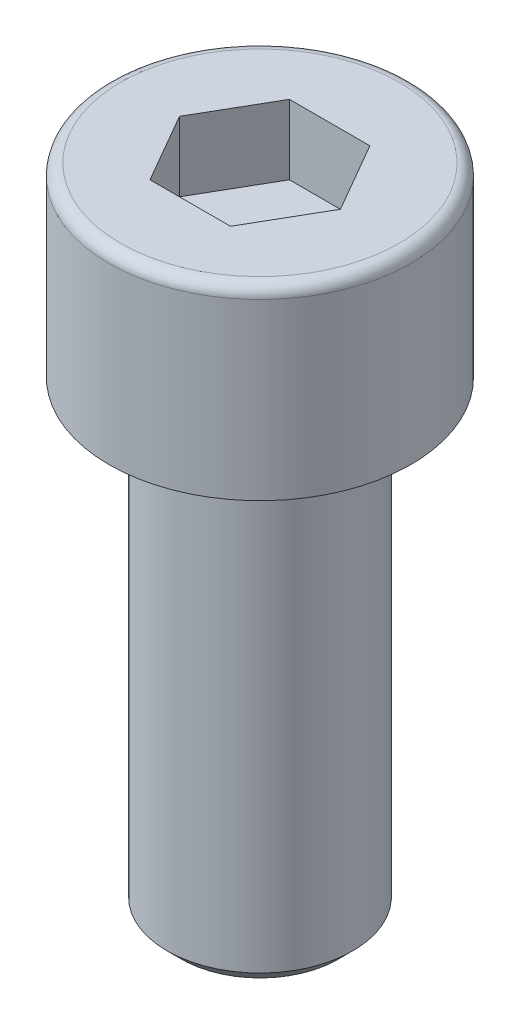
SolidWorks part; units mm, degrees
ref_plane "Plan1" through (0, 0, 0) normal (0, 0, 1) x (1, 0, 0)
ref_plane "Plan2" through (0, 0, 0) normal (0, 1, 0) x (1, 0, 0)
ref_plane "Plan3" through (0, 0, 0) normal (1, 0, 0) x (0, 0, -1)
sketch "Esquisse1" plane through (0, 0, 0) normal (0, 0, 1) x (1, 0, 0)
  line L0 (0, 50) -> (0, -40) construction
  line L1 (0, 28) -> (-6, 28)
  line L3 (-6.5, 27.5) -> (-6.5, 20)
  line L4 (-6.5, 20) -> (-4, 20)
  line L7 (-4, 20) -> (-4, 0)
  line L12 (-4, 0) -> (0, 0)
  line L13 (0, 28) -> (0, 0)
  arc A0 (-6.5, 27.5) -> (-6, 28) centre (-6, 27.5) cw
  dimension "D1" = 0.5
  dimension "D2" = 6.5
  dimension "D3" = 20
  dimension "D4" = 8
  dimension "D7" = 4
revolve "Base-Révolution" add sketch "Esquisse1" angle 360 about L0
chamfer "Chanfrein1" distance 0.625 angle 45
sketch "Esquisse4" plane through (0, 28, 0) normal (0, 1, 0) x (-1, 0, 0)
  line L1 (3.4641, 0) -> (1.7321, 3)
  line L2 (1.7321, 3) -> (-1.7321, 3)
  line L3 (-1.7321, 3) -> (-3.4641, 0)
  line L4 (-3.4641, 0) -> (-1.7321, -3)
  line L5 (-1.7321, -3) -> (1.7321, -3)
  line L6 (1.7321, -3) -> (3.4641, 0)
  circle A0 centre (0, 0) radius 3 construction
  dimension "D1" = 6
extrude "Enlèv. mat.-Extru.3" cut sketch "Esquisse4" against normal blind 3
